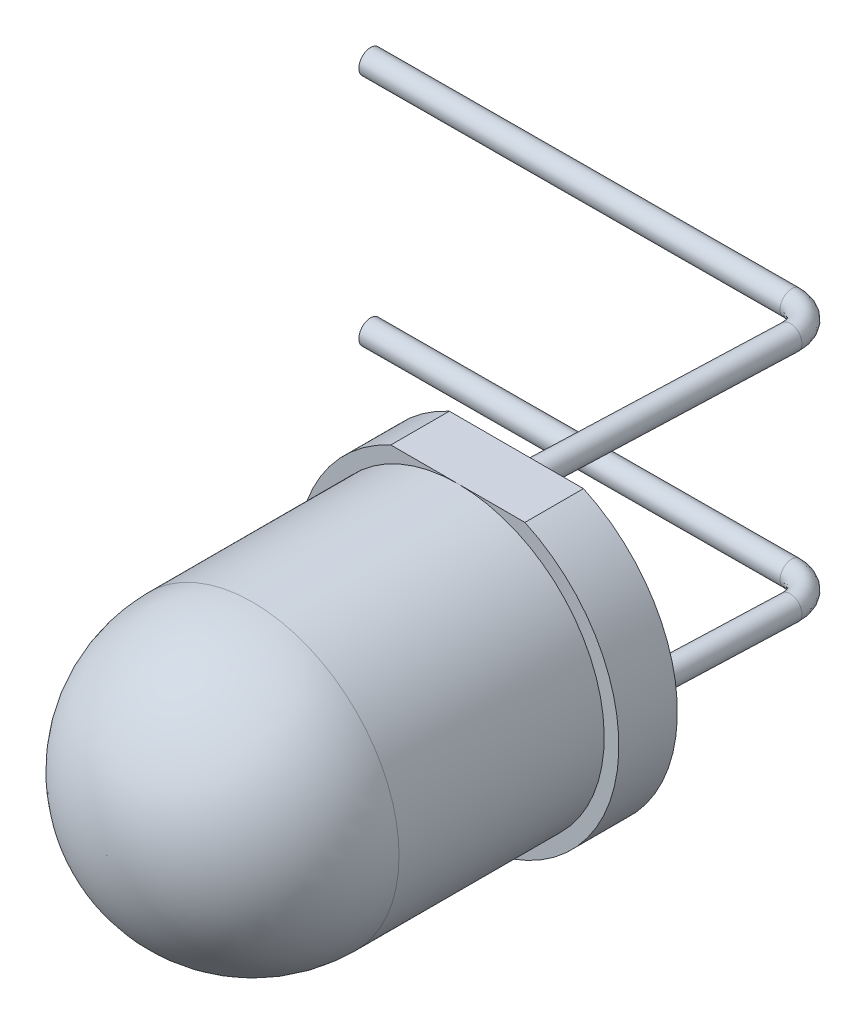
SolidWorks part; units mm, degrees
ref_plane "Face" through (0, 0, 0) normal (0, 0, 1) x (1, 0, 0)
ref_plane "Dessus" through (0, 0, 0) normal (0, 1, 0) x (1, 0, 0)
ref_plane "Droite" through (0, 0, 0) normal (1, 0, 0) x (0, 0, -1)
sketch "Esquisse1" plane through (0, 0, 0) normal (0, 0, 1) x (1, 0, 0)
  circle A0 centre (0, 0) radius 5
extrude "Base-Extrusion" add sketch "Esquisse1" along normal blind 14
fillet "Congé1" radius 4.99 1 edges at (5, 0, 14)
sketch "Esquisse2" plane through (0, 0, 0) normal (0, 0, -1) x (-1, 0, 0)
  circle A0 centre (0, 0) radius 5.5
extrude "Boss.-Extru.1" add sketch "Esquisse2" against normal blind 2
ref_plane "Plan1" through (0, 4, 0) normal (0, 1, 0) x (-1, 0, 0)
sketch "Esquisse3" plane through (0, 4, 0) normal (0, 1, 0) x (-1, 0, 0)
  line L0 (-8.34, 0) -> (12.3587, 0) construction
  line L1 (-8.34, -5) -> (9.7228, -5) construction
  line L2 (0, 2) -> (0, -7.8218) construction
  line L3 (0, 0) -> (-0.3356, -9.0211)
  line L4 (0.6677, -10.0582) -> (15, -10)
  arc A0 (0.6677, -10.0582) -> (-0.3356, -9.0211) centre (0.6637, -9.0583) cw
  dimension "D1" = 1
sketch "Esquisse4" plane through (0, 0, 0) normal (0, 0, -1) x (-1, 0, 0)
  line L0 (0, 3.8758) -> (0, -2.0542) construction
  circle A0 centre (0, 4) radius 0.4
sweep "Boss.-Balayage1" add profiles "Esquisse4" path "Esquisse3"
ref_plane "Plan2" through (0, -4, 0) normal (0, 1, 0) x (-1, 0, 0)
sketch "Esquisse5" plane through (0, -4, 0) normal (0, 1, 0) x (-1, 0, 0)
  line L0 (0, 1.4763) -> (0, -6.5538) construction
  line L1 (4.1286, -5) -> (-5.2346, -5) construction
  line L2 (4, -3.0942) -> (4, -7.8869) construction
  line L3 (0, 0) -> (-0.3356, -9.0211)
  line L4 (0.6677, -10.0582) -> (15, -10)
  arc A0 (0.6677, -10.0582) -> (-0.3356, -9.0211) centre (0.6637, -9.0583) cw
  dimension "D1" = 1
sketch "Esquisse6" plane through (0, 0, 0) normal (0, 0, -1) x (-1, 0, 0)
  line L0 (0, 3.4892) -> (0, -4.0013) construction
  circle A0 centre (0, -4) radius 0.4
sweep "Boss.-Balayage2" add profiles "Esquisse6" path "Esquisse5"
sketch "Esquisse7" plane through (0, 0, 0) normal (0, 0, -1) x (-1, 0, 0)
  line L0 (-4.1604, 5) -> (7.8871, 5) construction
  line L2 (5.0495, 5) -> (-4.1604, 5)
  line L3 (5.0495, 5) -> (5.0495, 8.6455)
  line L4 (5.0495, 8.6455) -> (-4.1604, 8.6455)
  line L5 (-4.1604, 5) -> (-4.1604, 8.6455)
extrude "Enlèv. mat.-Extru.1" cut sketch "Esquisse7" against normal blind 12
